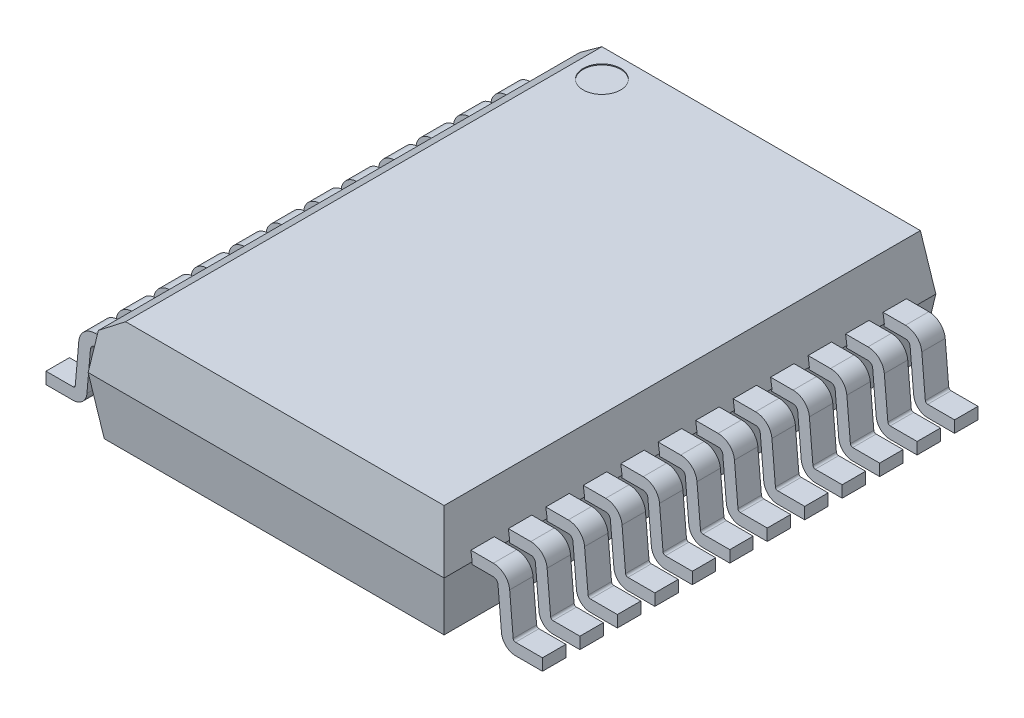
SolidWorks part; units mm, degrees
ref_plane "Front" through (0, 0, 0) normal (0, 0, 1) x (1, 0, 0)
ref_plane "Top" through (0, 0, 0) normal (0, 1, 0) x (1, 0, 0)
ref_plane "Right" through (0, 0, 0) normal (1, 0, 0) x (0, 0, -1)
ref_plane "ПлоскостьВывод1" through (0, 0, -4.4) normal (0, 0, 1) x (1, 0, 0)
sketch "ЭскизВывод1" plane through (0, 0, -4.4) normal (0, 0, 1) x (1, 0, 0)
  line L0 (-5.3, 0) -> (-4.7249, 0)
  line L1 (-4.426, 0.2739) -> (-4.3508, 1.1337)
  line L2 (-4.2512, 1.225) -> (4.2512, 1.225)
  line L3 (0, 1.225) -> (0, 0) construction
  line L4 (4.426, 0.2739) -> (4.3508, 1.1337)
  line L5 (5.3, 0) -> (4.7249, 0)
  arc A0 (-4.3508, 1.1337) -> (-4.2512, 1.225) centre (-4.2512, 1.125) cw
  arc A1 (-4.7249, 0) -> (-4.426, 0.2739) centre (-4.7249, 0.3) ccw
  arc A2 (4.7249, 0) -> (4.426, 0.2739) centre (4.7249, 0.3) cw
  arc A3 (4.3508, 1.1337) -> (4.2512, 1.225) centre (4.2512, 1.125) ccw
  point P8 (-4.3428, 1.225)
  point P11 (-4.45, 0)
  dimension "D6" = 0.1
  dimension "D7" = 0.3
  dimension "E" = 10.6
  dimension "A_mid_lead" = 1.225
  dimension "L" = 0.85
  dimension "D4" = 85
  dimension "D5" = 8.6857
extrude "Вывод1" add sketch "ЭскизВывод1" along normal mid plane 0.5 thin
ref_plane "ПлоскостьКорпус" through (0, 1.275, 0) normal (0, 1, 0) x (-1, 0, 0)
sketch "ЭскизКорпус" plane through (0, 1.275, 0) normal (0, 1, 0) x (1, 0, 0)
  line L1 (3.8, -5.25) -> (-3.8, -5.25)
  line L2 (3.8, -5.25) -> (3.8, 5.25)
  line L3 (3.8, 5.25) -> (-3.8, 5.25)
  line L4 (-3.8, -5.25) -> (-3.8, 5.25)
  line L5 (3.8, -5.25) -> (-3.8, 5.25) construction
  line L6 (3.8, 5.25) -> (-3.8, -5.25) construction
  point P0 (0, 0)
  dimension "D" = 10.5
  dimension "E" = 7.6
extrude "Корпус" add sketch "ЭскизКорпус" along normal offset from surface 2.45 draft 8 and the other way offset from surface (1.225 mm away) 0.05 draft 8
pattern_linear "Выводы" count 12 spacing 0.8 along (0, 0, 1) of "Вывод1"
chamfer "Фаска1" distance 0.4 angle 45 1 edges at (-3.6349, 2.45, 0)
sketch "Эскиз3" plane through (0, 2.45, 0) normal (0, 1, 0) x (1, 0, 0)
  line L0 (-3.1649, 4.4849) -> (-2.5649, 4.4849) construction
  line L1 (-3.1649, 5.0849) -> (-3.1649, -5.0849) construction
  line L2 (-2.5649, 4.4849) -> (-2.5649, 5.0849) construction
  line L3 (3.6349, 5.0849) -> (-3.1649, 5.0849) construction
  circle A0 centre (-2.5649, 4.4849) radius 0.4
  dimension "D2" = 0.8
  dimension "D1" = 0.6
extrude "Вытянуть3" cut sketch "Эскиз3" against normal blind 0.02
sketch "SkThermalPad" plane through (0, 1.275, 0) normal (0, 1, 0) x (-1, 0, 0)
  line L1 (2.5, 2.75) -> (-2.5, 2.75)
  line L2 (2.5, 2.75) -> (2.5, -2.75)
  line L3 (2.5, -2.75) -> (-2.5, -2.75)
  line L4 (-2.5, 2.75) -> (-2.5, -2.75)
  line L5 (2.5, 2.75) -> (-2.5, -2.75) construction
  line L6 (2.5, -2.75) -> (-2.5, 2.75) construction
  point P0 (0, 0)
  dimension "D1" = 5.5
  dimension "E2" = 5
extrude "ThermalPad" add sketch "SkThermalPad" against normal up to surface (1.275 mm away)
